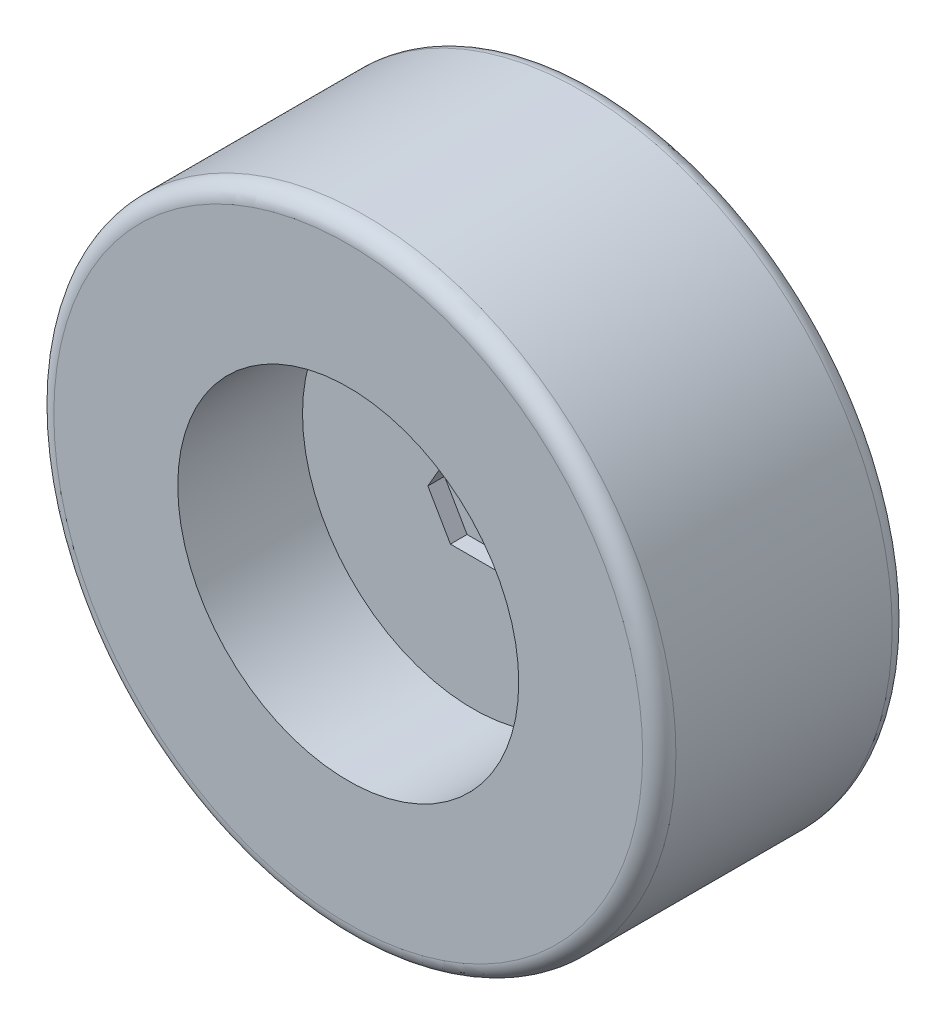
SolidWorks part; units mm, degrees
ref_plane "Front Plane" through (0, 0, 0) normal (0, 0, 1) x (1, 0, 0)
ref_plane "Top Plane" through (0, 0, 0) normal (0, 1, 0) x (1, 0, 0)
ref_plane "Right Plane" through (0, 0, 0) normal (1, 0, 0) x (0, 0, -1)
sketch "Sketch1" plane through (0, 0, 0) normal (0, 0, 1) x (1, 0, 0)
  circle A0 centre (0, 0) radius 47.498
  dimension "D1" = 94.996
extrude "Boss-Extrude1" add sketch "Sketch1" along normal blind 38.1
sketch "Sketch2" plane through (0, 0, 38.1) normal (0, 0, 1) x (1, 0, 0)
  circle A0 centre (0, 0) radius 26.035
  dimension "D1" = 52.07
extrude "Cut-Extrude1" cut sketch "Sketch2" against normal blind 19.05
sketch "Sketch3" plane through (0, 0, 0) normal (0, 0, -1) x (-1, 0, 0)
  circle A0 centre (0, 0) radius 26.035
  dimension "D1" = 52.07
extrude "Cut-Extrude2" cut sketch "Sketch3" against normal blind 6.35
sketch "Sketch4" plane through (0, 0, 19.05) normal (0, 0, 1) x (1, 0, 0)
  line L1 (6.8924, 0) -> (3.4462, 5.969)
  line L2 (3.4462, 5.969) -> (-3.4462, 5.969)
  line L3 (-3.4462, 5.969) -> (-6.8924, 0)
  line L4 (-6.8924, 0) -> (-3.4462, -5.969)
  line L5 (-3.4462, -5.969) -> (3.4462, -5.969)
  line L6 (3.4462, -5.969) -> (6.8924, 0)
  circle A0 centre (0, 0) radius 5.969 construction
  dimension "D1" = 11.938
extrude "Cut-Extrude3" cut sketch "Sketch4" against normal blind 2.54
sketch "Sketch5" plane through (0, 0, 6.35) normal (0, 0, -1) x (-1, 0, 0)
  circle A0 centre (0, 0) radius 1.5875
  dimension "D1" = 3.175
extrude "Cut-Extrude4" cut sketch "Sketch5" against normal through all
fillet "Fillet1" radius 2.54 2 edges at (47.498, 0, 0) (47.498, 0, 38.1)
